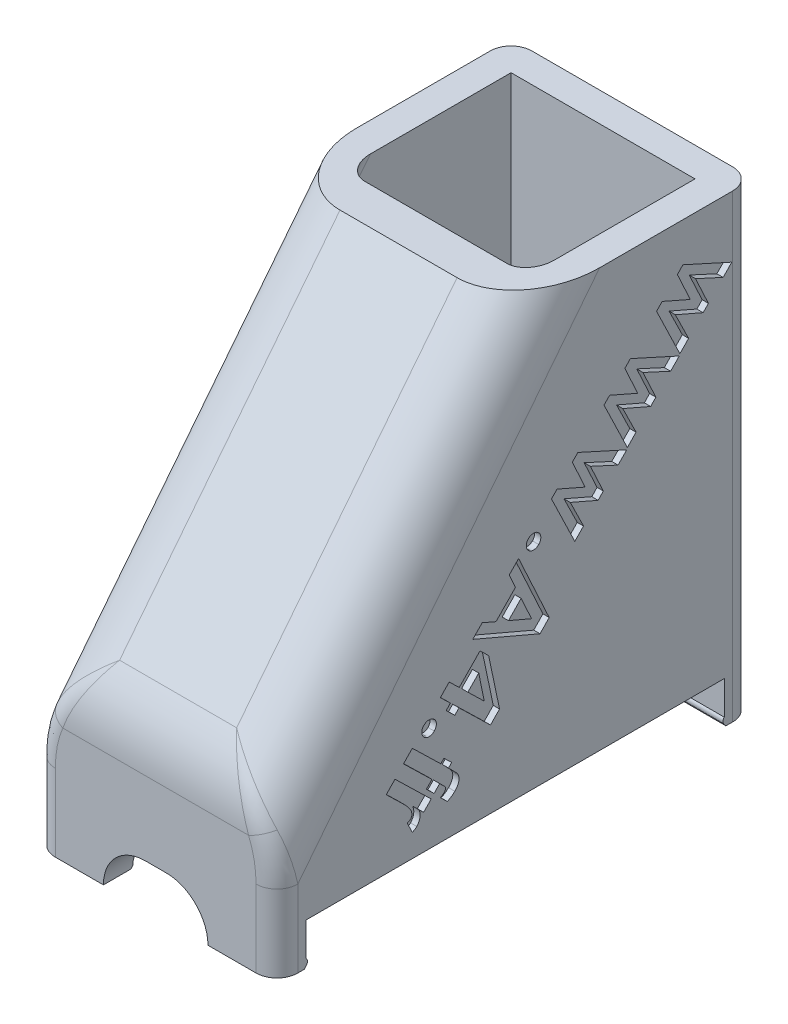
SolidWorks part; units mm, degrees
ref_plane "Plan de face" through (0, 0, 0) normal (0, 0, 1) x (1, 0, 0)
ref_plane "Plan de dessus" through (0, 0, 0) normal (0, 1, 0) x (1, 0, 0)
ref_plane "Plan de droite" through (0, 0, 0) normal (1, 0, 0) x (0, 0, -1)
sketch "Esquisse1" plane through (0, 0, 0) normal (0, 1, 0) x (1, 0, 0)
  line L0 (-8.0531, -11.997) -> (3.5469, -11.997)
  line L1 (-6.6531, -10.597) -> (2.1469, -10.597)
  line L2 (-6.6531, -10.597) -> (-6.6531, 9.403)
  line L3 (-6.6531, 9.403) -> (2.1469, 9.403)
  line L4 (2.1469, -10.597) -> (2.1469, 9.403)
  line L5 (3.5469, -11.997) -> (3.5469, 10.803)
  line L6 (-8.0531, 10.803) -> (3.5469, 10.803)
  line L7 (-8.0531, -11.997) -> (-8.0531, 10.803)
  dimension "D1" = 20
  dimension "D2" = 8.8
  dimension "D3" = 1.4
extrude "Boss.-Extru.1" add sketch "Esquisse1" along normal blind 20
sketch "Esquisse2" plane through (0, 0, 0) normal (0, -1, 0) x (1, 0, 0)
  line L0 (-6.6531, 10.597) -> (2.1469, 10.597) construction
  line L1 (-8.0531, 11.997) -> (3.5469, 11.997) construction
  line L2 (2.1469, -9.403) -> (-6.6531, -9.403) construction
  line L3 (3.5469, -10.803) -> (-8.0531, -10.803) construction
  line L4 (-6.6531, 10.597) -> (2.1469, 10.597)
  line L5 (-8.0531, 11.997) -> (3.5469, 11.997)
  line L6 (2.1469, -9.403) -> (-6.6531, -9.403)
  line L7 (3.5469, -10.803) -> (-8.0531, -10.803)
  line L8 (2.1469, 10.597) -> (3.5469, 10.597)
  line L9 (3.5469, 11.997) -> (3.5469, -10.803) construction
  line L10 (3.5469, 10.597) -> (3.5469, 11.997)
  line L11 (-6.6531, 10.597) -> (-8.0531, 10.597)
  line L12 (-8.0531, -10.803) -> (-8.0531, 11.997) construction
  line L13 (-8.0531, 10.597) -> (-8.0531, 11.997)
  line L14 (-6.6531, -9.403) -> (-8.0531, -9.403)
  line L15 (-8.0531, -9.403) -> (-8.0531, -10.803)
  line L16 (2.1469, -9.403) -> (3.5469, -9.403)
  line L17 (3.5469, -9.403) -> (3.5469, -10.803)
extrude "Boss.-Extru.2" add sketch "Esquisse2" along normal blind 4
sketch "Esquisse3" plane through (3.5469, 0, 0) normal (1, 0, 0) x (0, 0, -1)
  line L0 (0.1492, -1.6) -> (-15.2791, -1.6) construction
  line L2 (-0.597, 20) -> (-0.597, -4.3212) construction
  line L3 (-11.997, 20) -> (10.803, 20) construction
  line L4 (-10.597, 0) -> (9.403, 0) construction
  line L5 (-12.7476, -1.9) -> (-8.0063, -1.9) construction
  line L7 (-10.597, -4) -> (-10.597, 0) construction
  line L9 (-10.597, -4) -> (-10.597, 0) construction
  line L10 (-10.597, -1.6) -> (-10.6659, -1.6)
  line L11 (-10.6659, -1.6) -> (-10.6659, -1.9)
  line L12 (-10.6659, -1.9) -> (-10.597, -1.9)
  line L13 (9.4719, -1.6) -> (9.4719, -1.9)
  line L14 (9.4719, -1.9) -> (9.403, -1.9)
  line L15 (9.403, -1.6) -> (9.4719, -1.6)
  arc A0 (-10.597, -1.6) -> (-10.597, -1.9) centre (-10.747, -1.75) cw
  arc A1 (9.403, -1.6) -> (9.403, -1.9) centre (9.553, -1.75) ccw
  dimension "D2" = 0.3
  dimension "D1" = 1.6
extrude "Boss.-Extru.3" add sketch "Esquisse3" against normal up to surface (11.6 mm away)
sketch "Esquisse4" plane through (0, 20, 0) normal (0, 1, 0) x (1, 0, 0)
  line L0 (-2.2531, 10.803) -> (-2.2531, 3.7388) construction
  line L1 (3.5469, -11.997) -> (3.5469, 10.803) construction
  line L2 (2.1469, 9.403) -> (-6.6531, 9.403) construction
  line L3 (-8.0531, -0.597) -> (7.6152, -0.597) construction
  line L4 (-8.0531, 10.803) -> (-8.0531, -11.997) construction
  line L5 (-5.5531, -9.597) -> (-5.5531, -10.597)
  line L6 (-5.5531, 8.403) -> (1.0469, 8.403)
  line L7 (-5.5531, 8.403) -> (-5.5531, 9.403)
  line L8 (-5.5531, 9.403) -> (1.0469, 9.403)
  line L9 (1.0469, 8.403) -> (1.0469, 9.403)
  line L10 (-5.5531, 8.403) -> (1.0469, 9.403) construction
  line L11 (1.0469, -9.597) -> (1.0469, -10.597)
  line L12 (-5.5531, -10.597) -> (1.0469, -10.597)
  line L13 (-5.5531, -9.597) -> (1.0469, -9.597)
  line L15 (-5.5531, 9.403) -> (1.0469, 8.403) construction
  point P2 (-2.2531, 7.2709)
  dimension "D1" = 2.5
  dimension "D2" = 2.5
  dimension "D3" = 1
extrude "Enlèv. mat.-Extru.1" cut sketch "Esquisse4" against normal through all
sketch "Esquisse6" plane through (3.5469, 0, 0) normal (1, 0, 0) x (0, 0, -1)
  line L0 (1.403, 20) -> (-11.997, 3)
  line L1 (1.403, 20) -> (1.403, 20.5621)
  line L2 (-11.997, 20) -> (10.803, 20) construction
  line L3 (1.403, 20.5621) -> (-13.9983, 20.5621)
  line L4 (-13.9983, 20.5621) -> (-13.9983, 3)
  line L5 (-11.997, 3) -> (-13.9983, 3)
  line L6 (-11.997, 20) -> (-11.997, -4) construction
  line L7 (9.403, 20) -> (9.403, 0) construction
  line L8 (-10.597, 0) -> (9.403, 0) construction
  dimension "D1" = 8
  dimension "D2" = 3
extrude "Enlèv. mat.-Extru.2" cut sketch "Esquisse6" against normal through all
sketch "Esquisse7" plane through (3.5469, 0, 0) normal (1, 0, 0) x (0, 0, -1)
  line L0 (1.403, 20) -> (-0.3796, 20)
  line L1 (-11.997, 3) -> (-11.997, 5.2615)
  line L2 (-0.3796, 20) -> (-11.997, 5.2615)
  line L4 (0.3035, 20.8667) -> (-13.0965, 3.8667) construction
  line L11 (10.803, 20) -> (1.403, 20)
  line L12 (1.403, 20) -> (-11.997, 3)
  line L13 (-11.997, 3) -> (-11.997, -4)
  line L14 (-11.997, -4) -> (-10.597, -4)
  line L15 (-10.597, -1.6) -> (-10.597, 0)
  line L16 (-10.597, 0) -> (9.403, 0)
  line L17 (9.403, 0) -> (9.403, -1.6)
  line L18 (9.403, -4) -> (10.803, -4)
  line L19 (10.803, -4) -> (10.803, 20)
  line L21 (1.403, 20) -> (-11.997, 3)
  line L25 (-10.597, -4) -> (-10.597, -1.9)
  line L27 (9.403, -1.9) -> (9.403, -4)
  arc A2 (-10.597, -1.9) -> (-10.597, -1.6) centre (-10.747, -1.75) ccw
  arc A4 (9.403, -1.6) -> (9.403, -1.9) centre (9.553, -1.75) ccw
  dimension "D1" = 0
  dimension "D2" = 1.4
extrude "Boss.-Extru.4" add sketch "Esquisse7" against normal up to surface (11.6 mm away)
sketch "Esquisse8" plane through (3.5469, 0, 0) normal (1, 0, 0) x (0, 0, -1)
  line L0 (8.057, 18.7816) -> (-13.1406, -3.4055) construction
  text T0 "www.A4.fr" font "Century Gothic" height 3.3
extrude "Enlèv. mat.-Extru.3" cut sketch "Esquisse8" against normal blind 0.3
fillet "Congé1" radius 5 1 edges at (-2.2531, 5.2615, 11.997)
sketch "Esquisse9" plane through (0, -4, 0) normal (0, -1, 0) x (1, 0, 0)
  line L0 (-4.7531, -9.1612) -> (-4.7531, 12.7786) construction
  line L1 (0.2469, 10.3552) -> (0.2469, -12.4145) construction
  line L3 (0.2469, -11.2363) -> (-4.7531, -11.2363)
  line L4 (0.2469, -11.2363) -> (0.2469, 12.5427)
  line L5 (0.2469, 12.5427) -> (-4.7531, 12.5427)
  line L6 (-4.7531, -11.2363) -> (-4.7531, 12.5427)
  point P4 (0.2469, -11.7803)
extrude "Enlèv. mat.-Extru.4" cut sketch "Esquisse9" against normal up to surface (4 mm away)
fillet "Congé2" radius 3 2 edges at (-8.0531, 13.3115, 5.6517) (3.5469, 13.3115, 5.6517)
fillet "Congé3" radius 1 2 edges at (-6.6531, 12.3881, 4.597) (2.1469, 12.3881, 4.597)
fillet "Congé4" radius 2 4 edges at (0.2469, 0, 11.297) (-4.7531, 0, 11.297) (0.2469, 0, -10.103) (-4.7531, 0, -10.103)
fillet "Congé5" radius 1 2 edges at (3.5469, 8, -10.803) (-8.0531, 8, -10.803)
fillet "Congé6" radius 0.8 8 edges at (3.5469, -4, -9.603) (3.254, -4, -10.5101) (-8.0531, -4, -9.603) (-7.7602, -4, -10.5101) (1.8969, -4, 11.997) (1.3969, -4, -10.803) (-5.9031, -4, -10.803) (-6.4031, -4, 11.997)
sketch "Esquisse10" plane through (-8.0531, 0, 0) normal (-1, 0, 0) x (0, 0, 1)
  line L0 (-9.403, 0) -> (10.597, 0) construction
  line L1 (-9.403, 0) -> (10.597, 0) construction
  line L2 (-13.033, -2) -> (14.936, -2)
  line L3 (14.936, -2) -> (14.936, -5)
  line L4 (14.936, -5) -> (-13.033, -5)
  line L5 (-13.033, -5) -> (-13.033, -2)
  dimension "D1" = 2
  dimension "D2" = 3
extrude "Enlèv. mat.-Extru.5" cut sketch "Esquisse10" against normal mid plane 30
fillet "Congé7" radius 1 6 edges at (-6.2732, 5.2144, 11.704) (-7.8725, 2.0713, 11.997) (1.7671, 5.2144, 11.704) (3.3664, 2.0713, 11.997) (-8.0531, -0.7923, 11.997) (3.5469, -0.7923, 11.997)
sketch "Esquisse11" plane through (3.5469, 0, 0) normal (1, 0, 0) x (0, 0, -1)
  line L0 (-0.597, 0) -> (-0.597, -4.793) construction
  line L1 (-10.597, -1.9) -> (-10.7287, -2.0661)
  line L2 (-10.7287, -2.0661) -> (-10.4959, -2.0661)
  line L3 (-10.4959, -2.0661) -> (-10.4959, -1.7627)
  line L4 (-10.4959, -1.7627) -> (-10.597, -1.9)
  line L5 (9.3019, -1.7627) -> (9.403, -1.9)
  line L6 (9.3019, -2.0661) -> (9.3019, -1.7627)
  line L7 (9.5347, -2.0661) -> (9.3019, -2.0661)
  line L8 (9.403, -1.9) -> (9.5347, -2.0661)
extrude "Enlèv. mat.-Extru.6" cut sketch "Esquisse11" against normal through all
